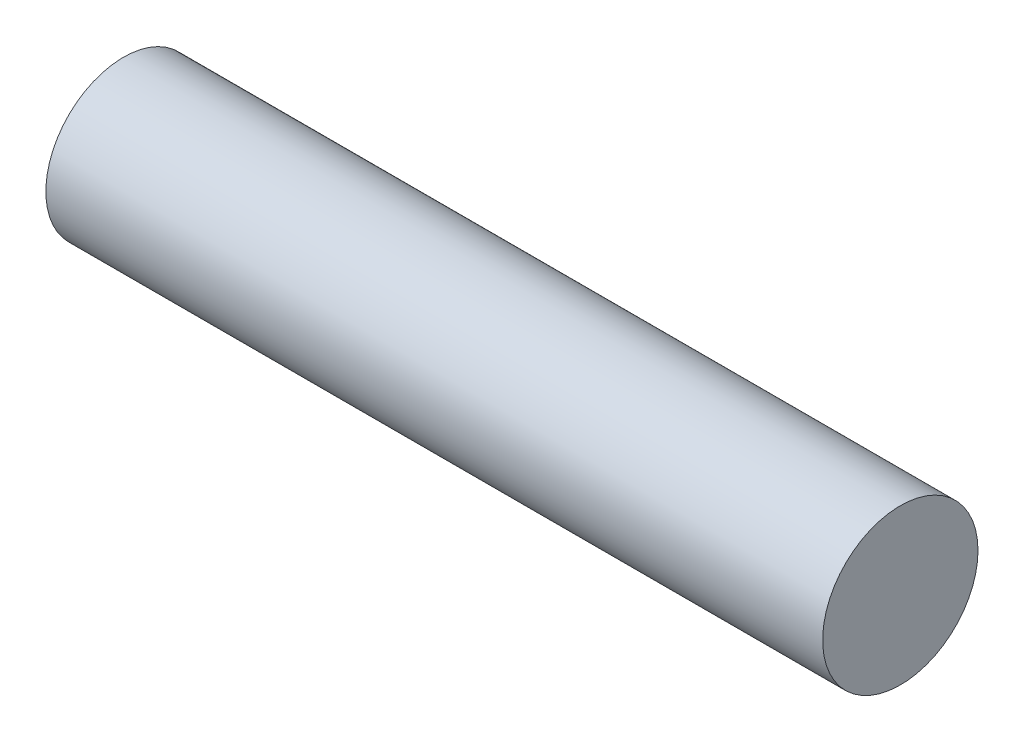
SolidWorks part; units mm, degrees
ref_plane "Front Plane" through (0, 0, 0) normal (0, 0, 1) x (1, 0, 0)
ref_plane "Top Plane" through (0, 0, 0) normal (0, 1, 0) x (1, 0, 0)
ref_plane "Right Plane" through (0, 0, 0) normal (1, 0, 0) x (0, 0, -1)
sketch "Sketch1" plane through (0, 0, 0) normal (1, 0, 0) x (0, 0, -1)
  circle A0 centre (0, 0) radius 3
  dimension "D1" = 6
extrude "Boss-Extrude1" add sketch "Sketch1" along normal blind 30
